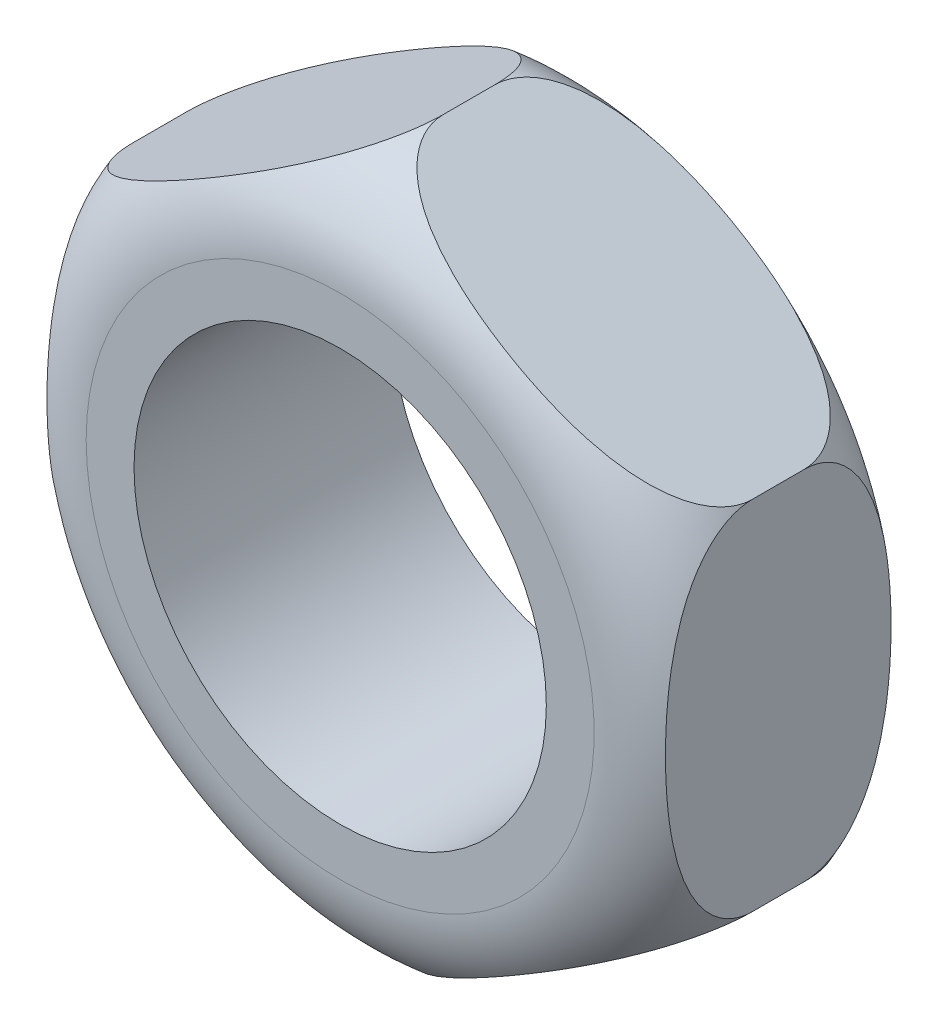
SolidWorks part; units mm, degrees
ref_plane "Front" through (0, 0, 0) normal (0, 0, 1) x (1, 0, 0)
ref_plane "Top" through (0, 0, 0) normal (0, 1, 0) x (1, 0, 0)
ref_plane "Right" through (0, 0, 0) normal (1, 0, 0) x (0, 0, -1)
sketch "Sketch1" plane through (0, 0, 0) normal (0, 0, 1) x (1, 0, 0)
  line L1 (0, -28.0718) -> (-6, -31.5359)
  line L2 (-6, -31.5359) -> (-6, -38.4641)
  line L3 (-6, -38.4641) -> (0, -41.9282)
  line L4 (0, -41.9282) -> (6, -38.4641)
  line L5 (6, -38.4641) -> (6, -31.5359)
  line L6 (6, -31.5359) -> (0, -28.0718)
  circle A1 centre (0, -35) radius 4
  circle A2 centre (0, -35) radius 6 construction
  dimension "D1" = 12
  dimension "D2" = 8
extrude "Extrude1" add sketch "Sketch1" along normal blind 5
ref_plane "Plane1" through (0, 0, 0) normal (1, 0, 0) x (0, 0, -1)
sketch "Sketch2" plane through (0, 0, 0) normal (1, 0, 0) x (0, 0, -1)
  line L0 (7, -35) -> (-2.8751, -35) construction
  line L5 (-5, -28.0718) -> (0, -28.0718) construction
  line L8 (0, -31.5359) -> (0, -28.0718) construction
  line L9 (-5, -28.0718) -> (0, -28.0718) construction
  line L10 (-2.5, -28.0718) -> (-2.5, -41.9282) construction
  line L11 (-5, -41.9282) -> (0, -41.9282) construction
  line L12 (0, -30.0718) -> (1.3083, -30.0718)
  line L13 (1.3083, -30.0718) -> (1.3083, -25.3351)
  line L14 (1.3083, -25.3351) -> (-2, -25.3351)
  line L15 (-2, -25.3351) -> (-2, -28.0718)
  line L16 (-3, -25.3351) -> (-3, -28.0718)
  line L17 (-6.3083, -25.3351) -> (-3, -25.3351)
  line L18 (-6.3083, -30.0718) -> (-6.3083, -25.3351)
  line L19 (-5, -30.0718) -> (-6.3083, -30.0718)
  arc A0 (0, -30.0718) -> (-2, -28.0718) centre (-2, -30.0718) ccw
  arc A1 (-5, -30.0718) -> (-3, -28.0718) centre (-3, -30.0718) cw
  dimension "D1" = 2
revolve "Cut-Revolve1" cut sketch "Sketch2" angle 360 about L0
